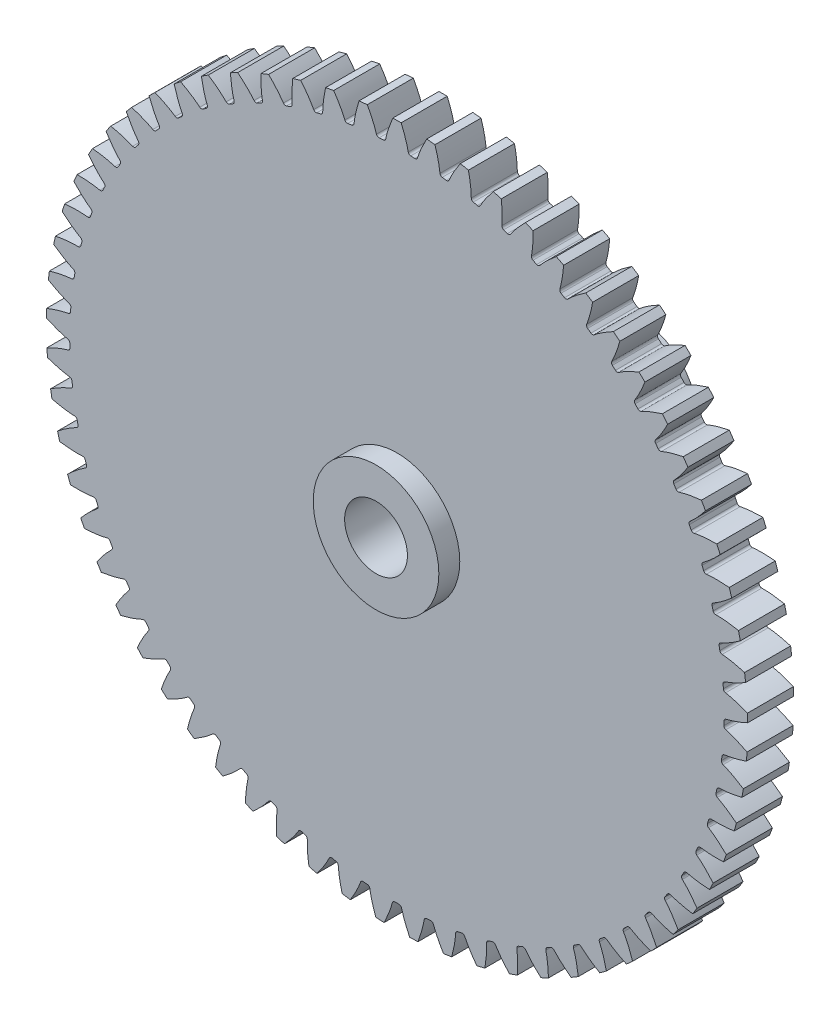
SolidWorks part; units mm, degrees
ref_plane "Face" through (0, 0, 0) normal (0, 0, 1) x (1, 0, 0)
ref_plane "Dessus" through (0, 0, 0) normal (0, 1, 0) x (1, 0, 0)
ref_plane "Droite" through (0, 0, 0) normal (1, 0, 0) x (0, 0, -1)
other "Joindre1"
other "Roue Z5 m=0,45 Z=18<1>@Z4-Z5"
other "Roue Z4 m=0,25 Z=65<1>@Z4-Z5"
sketch "Dp" plane through (0, 0, 0) normal (0, 0, -1) x (-1, 0, 0)
  circle A0 centre (0, 0) radius 4.05 construction
  circle A1 centre (0, 0) radius 7.5 construction
  dimension "D1" = 8.1
  dimension "D2" = 15
